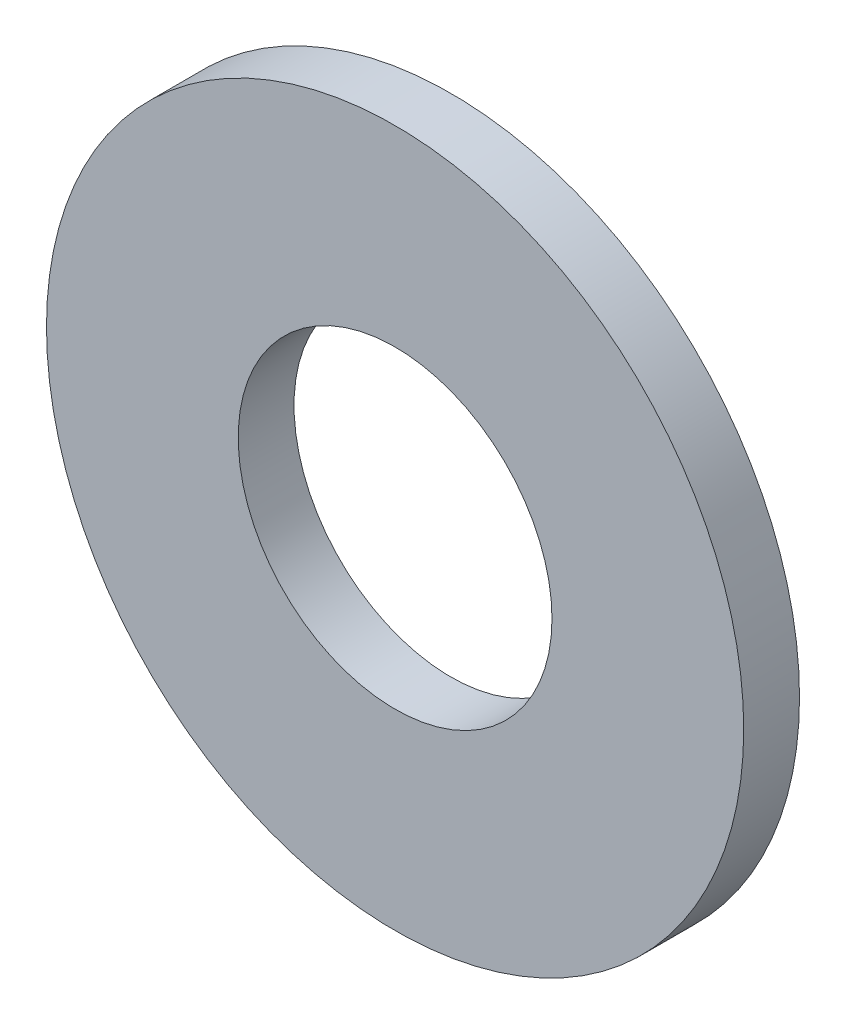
SolidWorks part; units mm, degrees
ref_plane "Front Plane" through (0, 0, 0) normal (0, 0, 1) x (1, 0, 0)
ref_plane "Top Plane" through (0, 0, 0) normal (0, 1, 0) x (1, 0, 0)
ref_plane "Right Plane" through (0, 0, 0) normal (1, 0, 0) x (0, 0, -1)
sketch "Sketch1" plane through (0, 0, 0) normal (0, 0, 1) x (1, 0, 0)
  circle A0 centre (0, 0) radius 3.5719
  circle A1 centre (0, 0) radius 7.9375
  dimension "ID" = 7.1437
  dimension "OD" = 15.875
extrude "Extrude1" add sketch "Sketch1" against normal blind 1.27
